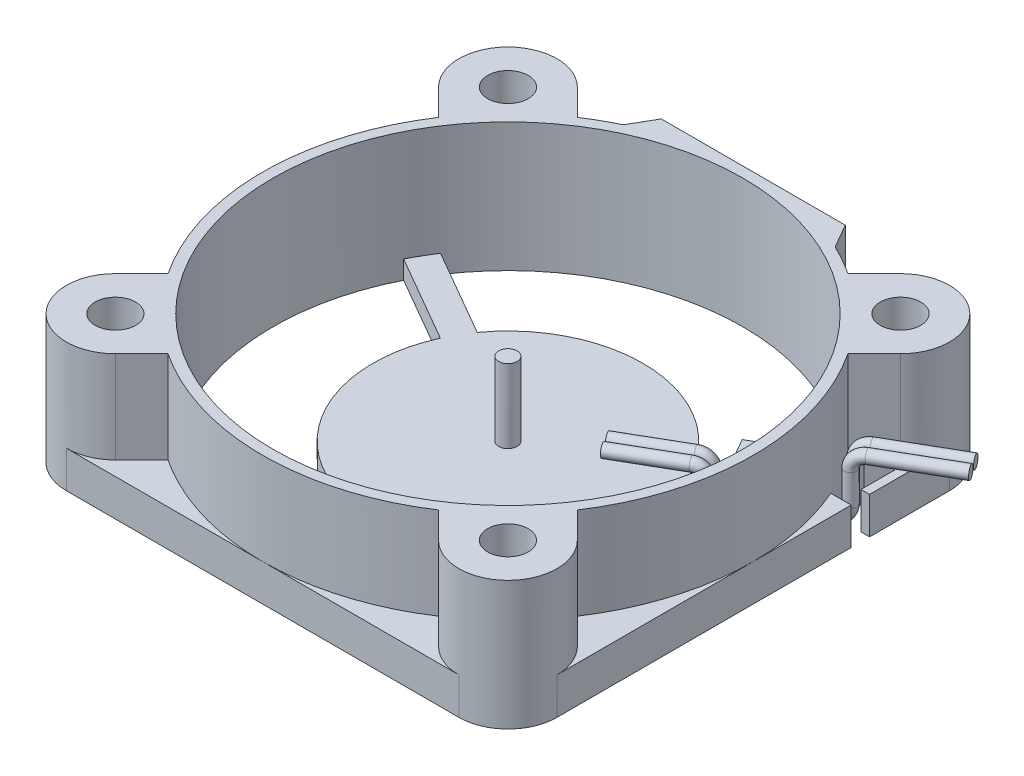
SolidWorks part; units mm, degrees
ref_plane "Front Plane" through (0, 0, 0) normal (0, 0, 1) x (1, 0, 0)
ref_plane "Top Plane" through (0, 0, 0) normal (0, 1, 0) x (1, 0, 0)
ref_plane "Right Plane" through (0, 0, 0) normal (1, 0, 0) x (0, 0, -1)
sketch "Sketch1" plane through (0, 0, 0) normal (0, 1, 0) x (1, 0, 0)
  line L0 (0, 20) -> (0, -20) construction
  line L1 (-16, -20) -> (16, -20)
  line L2 (-20, -16) -> (-20, 16)
  line L3 (-16, 20) -> (16, 20)
  line L4 (20, -16) -> (20, 16)
  line L5 (-20, -20) -> (20, 20) construction
  line L6 (-20, 20) -> (20, -20) construction
  line L7 (20, 0) -> (-20, 0) construction
  circle A0 centre (-16, 16) radius 1.65
  circle A1 centre (16, 16) radius 1.65
  circle A2 centre (-16, -16) radius 1.65
  circle A3 centre (16, -16) radius 1.65
  arc A4 (-16, -20) -> (-20, -16) centre (-16, -16) cw
  arc A5 (16, -20) -> (20, -16) centre (16, -16) ccw
  arc A6 (16, 20) -> (20, 16) centre (16, 16) cw
  arc A7 (-16, 20) -> (-20, 16) centre (-16, 16) ccw
  circle A8 centre (0, 0) radius 19.15
  point P0 (0, 0)
  dimension "D3" = 3.3
  dimension "D5" = 4
  dimension "D6" = 38.3
  dimension "D1" = 40
  dimension "D2" = 40
  dimension "D4" = 32
extrude "Boss-Extrude1" add sketch "Sketch1" along normal blind 3
sketch "Sketch2" plane through (0, 3, 0) normal (0, 1, 0) x (1, 0, 0)
  line L0 (-13.1716, -18.8284) -> (-11.028, -16.6848)
  line L1 (-16, -16) -> (0, 0) construction
  line L2 (-18.8284, -13.1716) -> (-13.1716, -18.8284) construction
  line L3 (-20, -16) -> (-20, 0)
  line L4 (-18.8284, -13.1716) -> (-16.6848, -11.028)
  line L5 (-13.1716, 18.8284) -> (-11.028, 16.6848)
  line L6 (-18.8284, 13.1716) -> (-16.6848, 11.028)
  line L7 (18.8284, 13.1716) -> (16.6848, 11.028)
  line L8 (13.1716, 18.8284) -> (11.028, 16.6848)
  line L9 (13.1716, -18.8284) -> (11.028, -16.6848)
  line L10 (18.8284, -13.1716) -> (16.6848, -11.028)
  arc A0 (-13.1716, 18.8284) -> (-18.8284, 13.1716) centre (-16, 16) ccw
  circle A1 centre (0, 0) radius 19.15 construction
  circle A2 centre (0, 0) radius 20
  arc A3 (-11.028, -16.6848) -> (11.028, -16.6848) centre (0, 0) ccw
  circle A4 centre (0, 0) radius 19.15
  arc A5 (18.8284, 13.1716) -> (13.1716, 18.8284) centre (16, 16) ccw
  arc A6 (13.1716, -18.8284) -> (18.8284, -13.1716) centre (16, -16) ccw
  arc A7 (-18.8284, -13.1716) -> (-13.1716, -18.8284) centre (-16, -16) ccw
  arc A8 (-16.6848, 11.028) -> (-16.6848, -11.028) centre (0, 0) ccw
  arc A9 (11.028, 16.6848) -> (-11.028, 16.6848) centre (0, 0) ccw
  arc A10 (16.6848, -11.028) -> (16.6848, 11.028) centre (0, 0) ccw
  circle A11 centre (-16, -16) radius 1.65 construction
  circle A12 centre (-16, -16) radius 1.65
  circle A13 centre (-16, 16) radius 1.65
  circle A14 centre (16, 16) radius 1.65
  circle A15 centre (16, -16) radius 1.65
  point P7 (-16, -16)
  point P31 (0, 0)
  dimension "D2" = 4
  dimension "D1" = 0.85
extrude "Boss-Extrude2" add sketch "Sketch2" along normal blind 7.5 contours L10 A10 L7 A5 L8 A9 L5 A0 L6 A8 L4 A7 L0 A3 L9 A6 M25 M26 M23 M24 M3 M12 M14 M13 M2
sketch "Sketch3" plane through (0, 0, 0) normal (0, -1, 0) x (1, 0, 0)
  line L0 (0, 0) -> (0, 19.15) construction
  line L1 (1.1, 10.9449) -> (1.1, 19.1184)
  line L2 (-1.1, 10.9449) -> (-1.1, 19.1184)
  line L3 (18.1054, -6.2385) -> (10.8116, -2.0274)
  line L4 (1.1, 11) -> (1.1, 19.15) construction
  line L5 (-1.1, 11) -> (-1.1, 19.15) construction
  line L6 (14.4554, -12.5605) -> (7.1616, -8.3494)
  line L7 (-10.0285, -4.5198) -> (-17.107, -8.6066)
  line L8 (-8.9285, -6.4251) -> (-16.007, -10.5118)
  line L9 (16.5844, -9.575) -> (0, 0) construction
  line L10 (0, 11) -> (0, 19.15) construction
  line L11 (10.0285, -4.5198) -> (17.107, -8.6066)
  line L12 (8.9285, -6.4251) -> (16.007, -10.5118)
  line L13 (18.4094, -6.414) -> (1.825, 3.161) construction
  line L14 (14.7594, -12.736) -> (-1.825, -3.161) construction
  arc A0 (-1.1, 10.9449) -> (-10.0285, -4.5198) centre (0, 0) ccw
  circle A1 centre (0, 0) radius 19.15 construction
  arc A2 (1.1, 19.1184) -> (-1.1, 19.1184) centre (0, 0) ccw
  arc A3 (14.4554, -12.5605) -> (18.1054, -6.2385) centre (0, 0) ccw
  arc A4 (-17.107, -8.6066) -> (-16.007, -10.5118) centre (0, 0) ccw
  arc A5 (-8.9285, -6.4251) -> (7.1616, -8.3494) centre (0, 0) ccw
  arc A6 (10.8116, -2.0274) -> (1.1, 10.9449) centre (0, 0) ccw
  arc A7 (16.007, -10.5118) -> (17.107, -8.6066) centre (0, 0) ccw
  point P23 (0, 0)
  dimension "D1" = 22
  dimension "D7" = 120
  dimension "D2" = 1.1
  dimension "D3" = 1.1
  dimension "D5" = 3.65
  dimension "D6" = 3.65
  dimension "D4" = 3
extrude "Boss-Extrude3" add sketch "Sketch3" against normal blind 1.5
sketch "Sketch4" plane through (0, 0, 0) normal (0, -1, 0) x (1, 0, 0)
  line L0 (7.1616, -8.3494) -> (14.4554, -12.5605) construction
  line L1 (7.1616, -8.3494) -> (9.4333, -9.661)
  line L3 (9.4333, -9.661) -> (12.0833, -5.0711)
  line L4 (17.1054, -7.9705) -> (9.8116, -3.7594)
  line L5 (12.0833, -5.0711) -> (10.2435, -4.0088)
  arc A0 (-8.9285, -6.4251) -> (7.1616, -8.3494) centre (0, 0) ccw construction
  arc A1 (7.1616, -8.3494) -> (10.2435, -4.0088) centre (0, 0) ccw
  dimension "D2" = 2
  dimension "D1" = 2
extrude "Cut-Extrude1" cut sketch "Sketch4" against normal through all
sketch "Sketch5" plane through (0, 0, 0) normal (0, -1, 0) x (1, 0, 0)
  line L0 (9.4333, -9.661) -> (12.0833, -5.0711) construction
  line L2 (9.9333, -8.795) -> (12.0833, -5.0711)
  line L5 (17.1054, -7.9705) -> (18.3386, -7.9809)
  line L6 (17.1054, -7.9705) -> (9.8116, -3.7594)
  line L7 (17.1054, -7.9705) -> (12.0833, -5.0711)
  line L8 (9.9333, -8.795) -> (14.9554, -11.6944)
  line L9 (9.9333, -8.795) -> (15.8428, -12.2068)
  arc A0 (16.6848, -11.028) -> (20, 0) centre (0, 0) ccw construction
  arc A1 (15.8428, -12.2068) -> (18.3386, -7.9809) centre (0, 0) ccw
  dimension "D1" = 2
  dimension "D2" = 1
extrude "Cut-Extrude2" cut sketch "Sketch5" against normal blind 1.1
sketch "Sketch6" plane through (0, 0, 0) normal (0, -1, 0) x (1, 0, 0)
  line L0 (18.8284, -13.1716) -> (16.6848, -11.028) construction
  line L1 (18.8284, -13.1716) -> (16.6848, -11.028)
  line L3 (19.3, -12.2068) -> (18.8284, -13.1716)
  line L4 (19.3, 16) -> (19.3, -16)
  line L5 (19.3, -9.4807) -> (19.3, -12.2068)
  line L6 (19.3, -9.4807) -> (20, -9.4807)
  line L7 (20, 16) -> (20, -16) construction
  line L8 (20, -9.4807) -> (20, -7.9809)
  line L9 (20, -7.9809) -> (18.3386, -7.9809)
  arc A0 (15.8428, -12.2068) -> (18.3386, -7.9809) centre (0, 0) ccw construction
  arc A1 (16.6848, -11.028) -> (18.3386, -7.9809) centre (0, 0) ccw
  dimension "D1" = 0.7
extrude "Cut-Extrude3" cut sketch "Sketch6" against normal up to next
sketch "Sketch7" plane through (0, 1.5, 0) normal (0, 1, 0) x (1, 0, 0)
  circle A0 centre (0, 0) radius 0.75
  dimension "D1" = 1.5
extrude "Boss-Extrude4" add sketch "Sketch7" along normal blind 6
sketch "Sketch8" plane through (0, 0, -20) normal (0, 0, -1) x (-1, 0, 0)
  line L0 (-16, 0) -> (16, 0) construction
  line L1 (-7.5, 10.5) -> (7.5, 10.5)
  line L2 (-7.5, 10.5) -> (-7.5, 0)
  line L3 (-7.5, 0) -> (7.5, 0)
  line L4 (7.5, 10.5) -> (7.5, 0)
  line L5 (-7.5, 10.5) -> (7.5, 0) construction
  line L6 (-7.5, 0) -> (7.5, 10.5) construction
  line L8 (11.028, 10.5) -> (-11.028, 10.5) construction
  point P0 (0, 5.25)
  dimension "D1" = 15
extrude "Boss-Extrude5" add sketch "Sketch8" against normal up to next
draft "Draft1" type of draft neutral plane draft angle 30 faces to draft 2 parameters "D1"=30
sketch "Sketch10" plane through (0, 0, -20) normal (0, 0, -1) x (-1, 0, 0)
  line L0 (-2.2582, 2.8625) -> (1.7418, 2.8625)
  line L1 (1.7418, 2.8625) -> (1.7418, 3.5125)
  line L2 (1.7418, 3.5125) -> (3.7418, 2.1625)
  line L3 (3.7418, 2.1625) -> (-2.2582, 2.1625) construction
  line L4 (1.7418, 0.8125) -> (3.7418, 2.1625)
  line L5 (1.7418, 1.4625) -> (1.7418, 0.8125)
  line L6 (-2.2582, 1.4625) -> (1.7418, 1.4625)
  line L7 (-2.2582, 2.8625) -> (-2.2582, 1.4625)
  line L8 (4.8686, 6.8711) -> (4.8686, 2.8711)
  line L9 (6.2686, 6.8711) -> (6.2686, 2.8711)
  line L10 (4.8686, 2.8711) -> (4.2186, 2.8711)
  line L11 (6.2686, 6.8711) -> (4.8686, 6.8711)
  line L12 (6.9186, 2.8711) -> (5.5686, 0.8711)
  line L13 (5.5686, 0.8711) -> (5.5686, 6.8711) construction
  line L14 (4.2186, 2.8711) -> (5.5686, 0.8711)
  line L15 (6.2686, 2.8711) -> (6.9186, 2.8711)
  dimension "D1" = 1.4
  dimension "D2" = 6
  dimension "D3" = 4
  dimension "D4" = 2.7
  dimension "D5" = 1.4
  dimension "D6" = 6
  dimension "D7" = 4
extrude "Boss-Extrude6" add sketch "Sketch10" along normal blind 0.2
ref_plane "Plane1" through (0.325, 0, 0.5629) normal (-0.5, 0, -0.866) x (-0.866, 0, 0.5)
sketch "Sketch12" plane through (0.325, 0, 0.5629) normal (-0.5, 0, -0.866) x (-0.866, 0, 0.5)
  line L0 (-12.1225, 1.3931) -> (-12.1225, 1.2974)
  line L1 (-13.1225, 0.2974) -> (-19.6224, 0.2974)
  line L2 (-20.6224, 1.2974) -> (-20.6224, 3.8481)
  line L3 (-21.6224, 4.8481) -> (-27.797, 4.8481)
  line L4 (-11.1225, 2.3931) -> (-5.826, 2.3931)
  arc A0 (-12.1225, 1.2974) -> (-13.1225, 0.2974) centre (-13.1225, 1.2974) cw
  arc A1 (-20.6224, 3.8481) -> (-21.6224, 4.8481) centre (-21.6224, 3.8481) ccw
  arc A2 (-19.6224, 0.2974) -> (-20.6224, 1.2974) centre (-19.6224, 1.2974) cw
  arc A3 (-12.1225, 1.3931) -> (-11.1225, 2.3931) centre (-11.1225, 1.3931) cw
  dimension "D1" = 1
ref_plane "Plane2" through (5.0455, 0, -2.913) normal (-0.866, 0, 0.5) x (0.5, 0, 0.866)
sketch "Sketch13" plane through (5.0455, 0, -2.913) normal (-0.866, 0, 0.5) x (0.5, 0, 0.866)
  circle A0 centre (0.65, 2.3931) radius 0.5
  circle A1 centre (-0.45, 2.3931) radius 0.5
  dimension "D1" = 1
  dimension "D2" = 1.1
sweep "Sweep4" add profiles "Sketch13" path "Sketch12"
ref_plane "Plane3" through (0.025, 0, 0.0433) normal (-0.5, 0, -0.866) x (-0.866, 0, 0.5)
